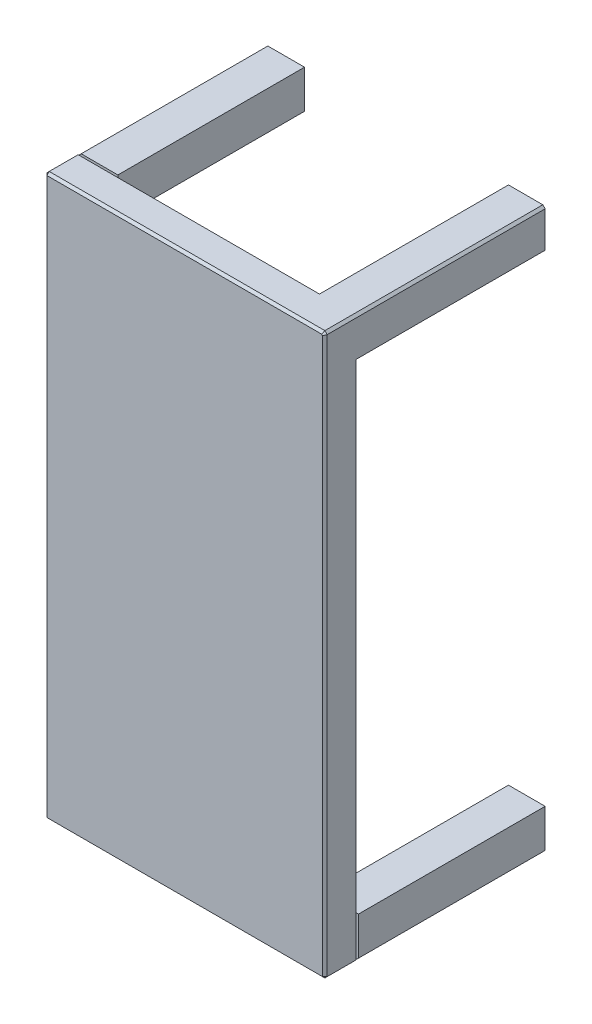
SolidWorks part; units mm, degrees
ref_plane "Front Plane" through (0, 0, 0) normal (0, 0, 1) x (1, 0, 0)
ref_plane "Top Plane" through (0, 0, 0) normal (0, 1, 0) x (1, 0, 0)
ref_plane "Right Plane" through (0, 0, 0) normal (1, 0, 0) x (0, 0, -1)
sketch "Sketch1" plane through (0, 0, 0) normal (0, 0, 1) x (1, 0, 0)
  line L1 (0, 0) -> (-304.8, 0)
  line L2 (0, 0) -> (0, -609.6)
  line L3 (0, -609.6) -> (-304.8, -609.6)
  line L4 (-304.8, 0) -> (-304.8, -609.6)
  dimension "D2" = 304.8
  dimension "D3" = 609.6
extrude "Extrude1" add sketch "Sketch1" along normal blind 36.576
sketch "Sketch2" plane through (0, 0, 0) normal (0, 0, -1) x (-1, 0, 0)
  line L1 (0, 0) -> (42.4276, 0)
  line L2 (0, 0) -> (0, -44.096)
  line L3 (0, -44.096) -> (42.4276, -44.096)
  line L4 (42.4276, 0) -> (42.4276, -44.096)
extrude "Extrude2" add sketch "Sketch2" along normal blind 202.946
chamfer "Chamfer3" distance 2.54 angle 45 1 edges
chamfer "Chamfer8" distance 2.54 angle 45 5 edges at (-42.4276, -44.096, -101.473) (0, 0, -83.185)
pattern_linear "LPattern2" count 2 spacing 565.15 along (0, -1, 0) count 2 spacing 261.62 along (-1, 0, 0) of "Extrude2"
chamfer "Chamfer9" distance 2.54 angle 45 3 edges at (-261.62, -609.246, -101.473) (-304.0476, -565.15, -101.473) (-304.0476, -609.246, -101.473)
chamfer "Chamfer10" distance 2.54 angle 45 3 edges at (-261.62, -44.096, -101.473) (-304.0476, 0, -101.473) (-304.0476, -44.096, -101.473)
chamfer "Chamfer11" distance 2.54 angle 45 3 edges at (0, -609.246, -101.473) (-42.4276, -609.246, -101.473) (-42.4276, -565.15, -101.473)
chamfer "Chamfer12" distance 2.54 angle 45 9 edges at (0, -609.6, 19.558) (-304.8, -609.6, 18.288) (0, -306.07, 36.576) (-152.4, -609.6, 36.576) (-1.27, -1.27, 36.576) (-153.67, 0, 36.576) (-304.8, -304.8, 36.576) (-304.8, 0, 19.558) (-304.8, -1.27, 1.27)
